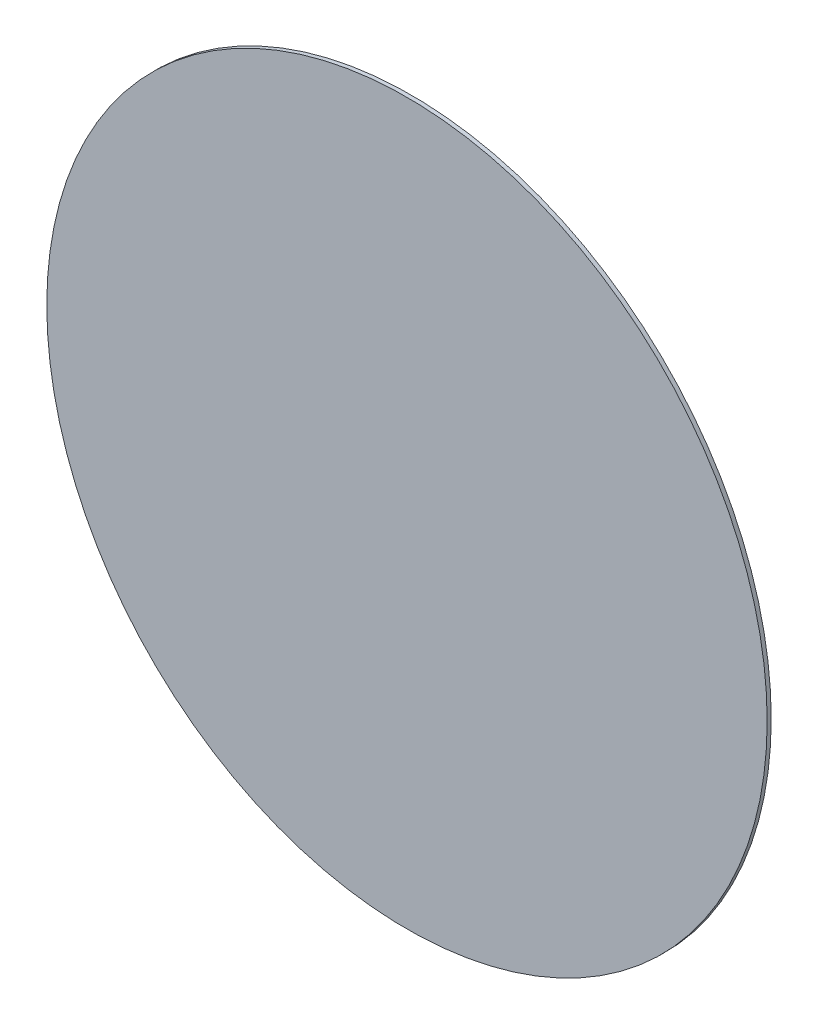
SolidWorks part; units mm, degrees
ref_plane "Plan de face" through (0, 0, 0) normal (0, 0, 1) x (1, 0, 0)
ref_plane "Plan de dessus" through (0, 0, 0) normal (0, 1, 0) x (1, 0, 0)
ref_plane "Plan de droite" through (0, 0, 0) normal (1, 0, 0) x (0, 0, -1)
sketch "Esquisse1" plane through (0, 0, 0) normal (0, 0, 1) x (1, 0, 0)
  circle A0 centre (0, 0) radius 178
  dimension "D1" = 356
extrude "Boss.-Extru.1" add sketch "Esquisse1" along normal blind 2
